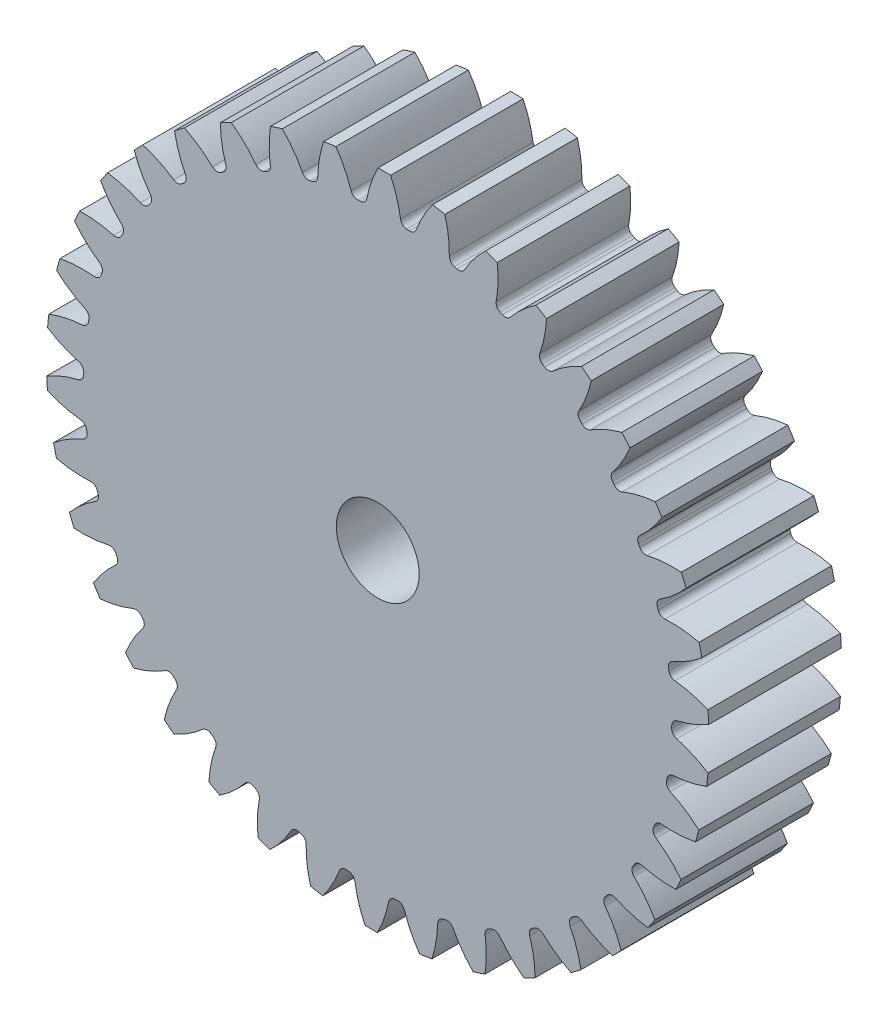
SolidWorks part; units mm, degrees
ref_plane "Front" through (0, 0, 0) normal (0, 0, 1) x (1, 0, 0)
ref_plane "Top" through (0, 0, 0) normal (0, 1, 0) x (1, 0, 0)
ref_plane "Right" through (0, 0, 0) normal (1, 0, 0) x (0, 0, -1)
sketch "Sketch3" plane through (0, 0, 0) normal (0, 0, 1) x (1, 0, 0)
  circle A0 centre (0, 0) radius 254
  dimension "od" = 508
extrude "gearBody" add sketch "Sketch3" along normal blind 101.6
sketch "Sketch2" plane through (0, 0, 0) normal (0, 0, 1) x (1, 0, 0)
  line L0 (0, 0) -> (209.4877, 86.7726) construction
  line L1 (253.3477, -21.4298) -> (0, 0) construction
  line L2 (0, 0) -> (36.3143, 0) construction
  line L3 (241.2454, 5.133) -> (240.8497, -14.7342) construction
  line L5 (241.0476, -4.8006) -> (0, 0) construction
  line L7 (0, 0) -> (226.7478, 0) construction
  arc A0 (226.7461, 0.8906) -> (226.5308, -9.9178) centre (0, 0) ccw construction
  arc A1 (253.7538, 11.181) -> (253.1074, -21.2754) centre (0, 0) ccw construction
  arc A2 (241.2454, 5.133) -> (240.8497, -14.7342) centre (0, 0) ccw construction
  arc A3 (225.3582, -5.4883) -> (225.398, -3.4888) centre (0, 0) ccw
  arc A4 (253.3477, -21.4298) -> (229.1516, -10.597) centre (205.8667, -95.0446) ccw
  arc A5 (253.3477, -21.4298) -> (254, 11.3257) centre (0, 0) ccw
  arc A6 (254, 11.3257) -> (229.3918, 1.4649) centre (209.4877, 86.7726) cw
  arc A7 (225.398, -3.4888) -> (229.3918, 1.4649) centre (230.5663, -3.5688) cw
  arc A8 (229.1516, -10.597) -> (225.3582, -5.4883) centre (230.5255, -5.6141) cw
  point P6 (254, 11.3257)
  point P22 (253.3477, -21.4298)
  dimension "baseDia" = 453.4957
  dimension "od" = 508
  dimension "pd" = 482.6
  dimension "rd" = 450.85
  dimension "rFillet" = 5.1689
  dimension "pointX" = 254
  dimension "pointY" = 11.3257
  dimension "CTT" = 19.8672
  dimension "flankCenterAngle" = 22.5
extrude "toothCut" cut sketch "Sketch2" along normal through all
pattern_circular "CirPattern1" count 38 over 360 about axis through (0, 0, 0) along (0, 0, 1) of "toothCut"
sketch "hub1Dia" plane through (0, 0, 0) normal (0, 0, -1) x (-1, 0, 0)
  circle A0 centre (0, 0) radius 12.7
  dimension "hub1Dia" = 25.4
sketch "hub2Dia" plane through (0, 0, 101.6) normal (0, 0, 1) x (1, 0, 0)
  circle A0 centre (0, 0) radius 12.7
  dimension "hub2dia" = 25.4
sketch "boreDia" plane through (0, 0, 0) normal (0, 0, 1) x (1, 0, 0)
  circle A0 centre (0, 0) radius 31.75
  dimension "boreDia" = 63.5
extrude "bore" cut sketch "boreDia" against normal mid plane 25400
